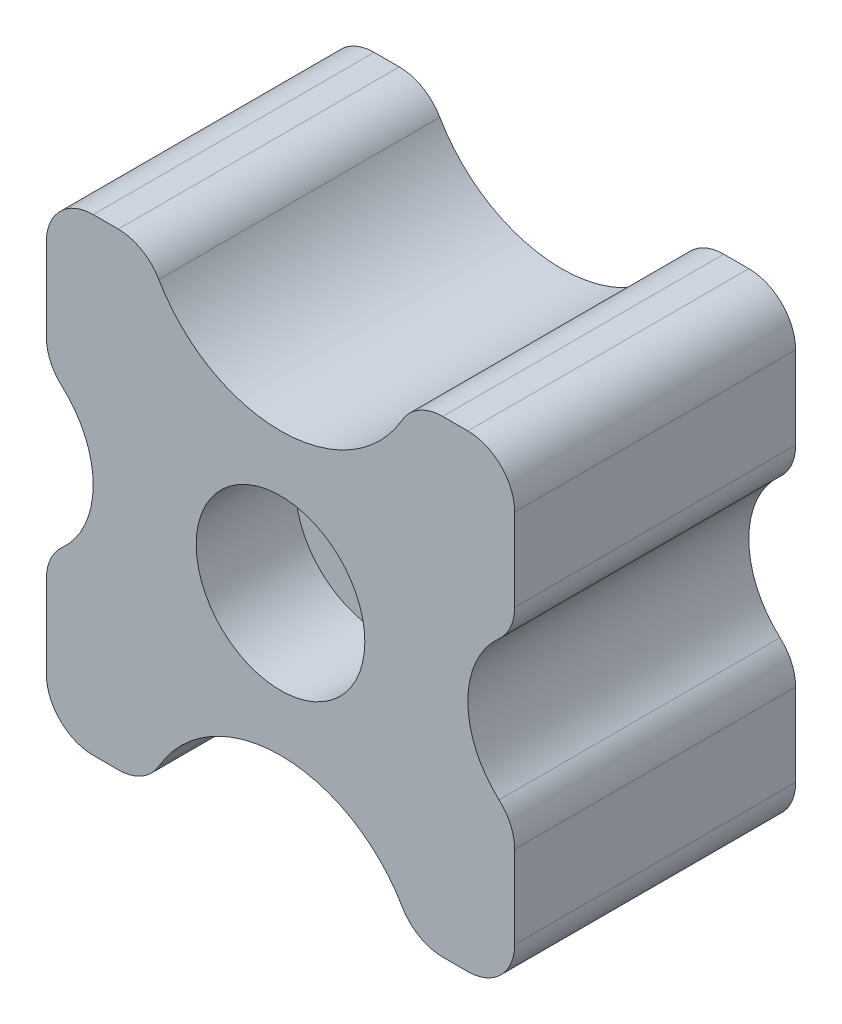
SolidWorks part; units mm, degrees
ref_plane "Ebene vorne" through (0, 0, 0) normal (0, 0, 1) x (1, 0, 0)
ref_plane "Ebene oben" through (0, 0, 0) normal (0, 1, 0) x (1, 0, 0)
ref_plane "Ebene rechts" through (0, 0, 0) normal (1, 0, 0) x (0, 0, -1)
sketch "Skizze1" plane through (0, 0, 0) normal (0, 0, 1) x (1, 0, 0)
  line L1 (-25, -25) -> (25, -25)
  line L2 (-25, -25) -> (-25, 25)
  line L3 (-25, 25) -> (25, 25)
  line L4 (25, -25) -> (25, 25)
  line L5 (-25, -25) -> (25, 25) construction
  line L6 (-25, 25) -> (25, -25) construction
  point P0 (0, 0)
  dimension "D1" = 50
  dimension "D2" = 50
extrude "Grundkörper" add sketch "Skizze1" along normal blind 30
sketch "Skizze2" plane through (0, 0, 0) normal (0, 0, 1) x (1, 0, 0)
  line L0 (30.2274, 0) -> (-31.7977, 0) construction
  line L1 (0, 26.3375) -> (0, -27.5509) construction
  circle A0 centre (-30, 0) radius 10
  circle A1 centre (0, -30) radius 15
  circle A2 centre (30, 0) radius 10
  circle A3 centre (0, 30) radius 15
  dimension "D1" = 20
  dimension "D3" = 30
  dimension "D2" = 30
  dimension "D4" = 30
extrude "Schnitt-Linear austragen1" cut sketch "Skizze2" along normal through all
fillet "Verrundung1" radius 5 12 edges at (25, -25, 15) (-25, -8.6603, 15) (-25, 8.6603, 15) (-25, -25, 15) (14.1421, -25, 15) (-14.1421, -25, 15) (25, 8.6603, 15) (25, -8.6603, 15) (25, 25, 15) (-14.1421, 25, 15) (14.1421, 25, 15) (-25, 25, 15)
hole_wizard "Stirnsenkung für M10 Zylinderschraube mit Innensechskant1" positions "Skizze4" profile "Skizze3" counterbore size "M10" standard "DIN"
sketch "Skizze4" plane through (0, 0, 30) normal (0, 0, 1) x (1, 0, 0)
  point P0 (0, 0)
sketch "Skizze3" plane through (0, 0, 30) normal (1, 0, 0) x (0, -1, 0)
  line L0 (0, 0) -> (0, 30)
  line L1 (0, 30) -> (5.5, 30)
  line L3 (5.5, 30) -> (5.5, 10.6)
  line L4 (5.5, 10.6) -> (9, 10.6)
  line L5 (9, 10.6) -> (9, 0)
  line L7 (9, 0) -> (0, 0)
  line L11 (0, -6.35) -> (0, 107.95) construction
  dimension "Bohrerdurchmesser" = 11
  dimension "Bohrungstiefe" = 30
  dimension "Senkdurchmesser2" = 18
  dimension "Senktiefe2" = 10.6
